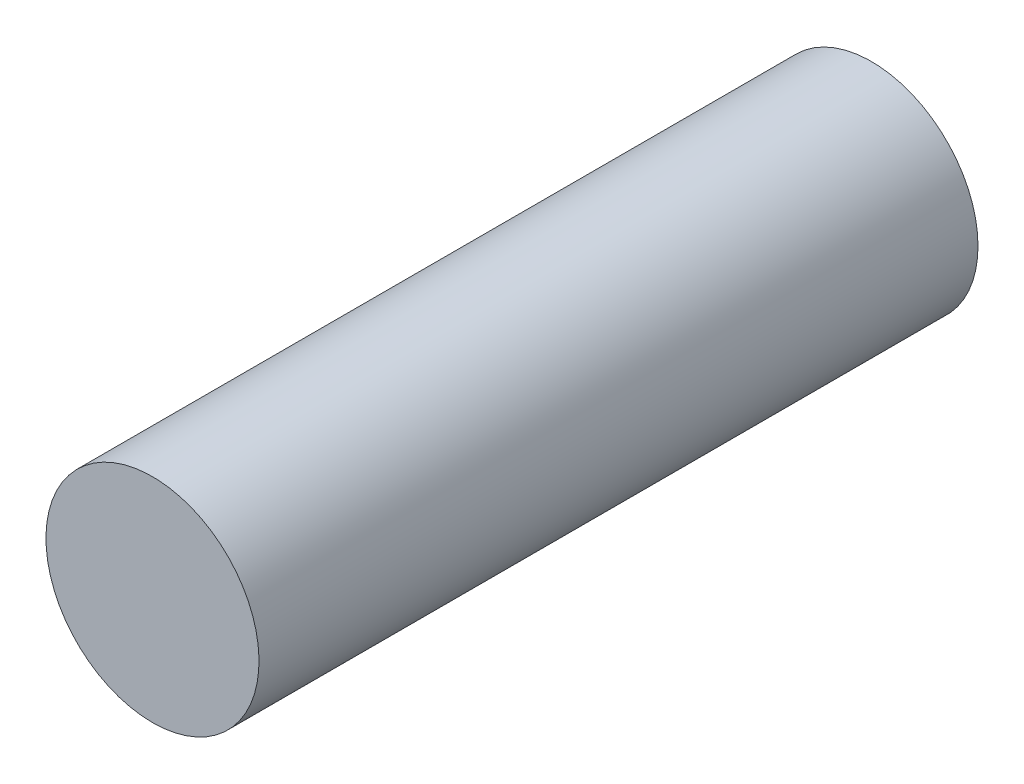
SolidWorks part; units mm, degrees
ref_plane "Plan de face" through (0, 0, 0) normal (0, 0, 1) x (1, 0, 0)
ref_plane "Plan de dessus" through (0, 0, 0) normal (0, 1, 0) x (1, 0, 0)
ref_plane "Plan de droite" through (0, 0, 0) normal (1, 0, 0) x (0, 0, -1)
sketch "Esquisse1" plane through (0, 0, 0) normal (0, 0, 1) x (1, 0, 0)
  circle A0 centre (43, 0) radius 10 construction
  circle A1 centre (43, 0) radius 10
extrude "Boss.-Extru.1" add sketch "Esquisse1" along normal up to surface (67.5 mm away)
